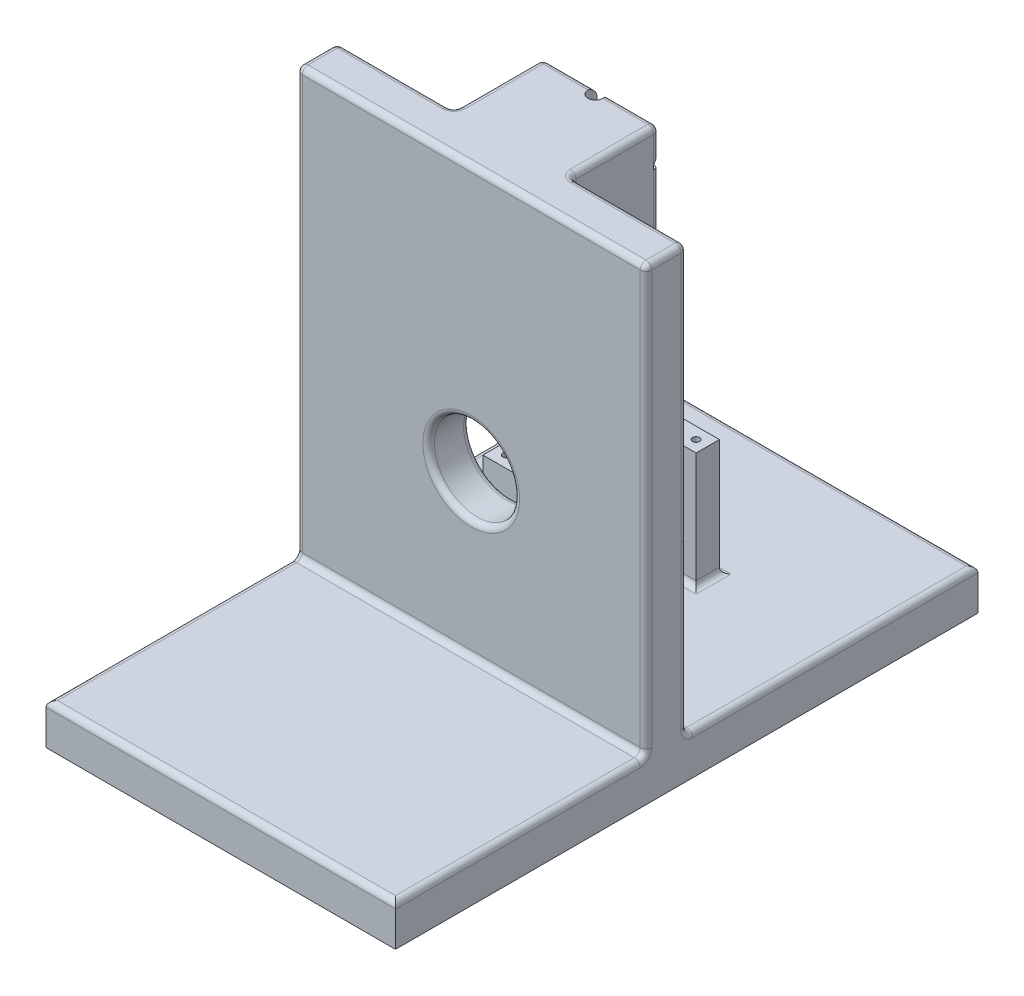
SolidWorks part; units mm, degrees
ref_plane "Płaszczyzna przednia" through (0, 0, 0) normal (0, 0, 1) x (1, 0, 0)
ref_plane "Płaszczyzna górna" through (0, 0, 0) normal (0, 1, 0) x (1, 0, 0)
ref_plane "Płaszczyzna prawa" through (0, 0, 0) normal (1, 0, 0) x (0, 0, -1)
sketch "Szkic2" plane through (0, 0, 0) normal (0, 1, 0) x (1, 0, 0)
  line L1 (300, 35) -> (-300, 35)
  line L2 (300, 35) -> (300, -35)
  line L3 (300, -35) -> (-300, -35)
  line L4 (-300, 35) -> (-300, -35)
  line L5 (300, 35) -> (-300, -35) construction
  line L6 (300, -35) -> (-300, 35) construction
  point P0 (0, 0)
  dimension "D1" = 600
  dimension "D2" = 70
extrude "Dodanie-wyciągnięcie1" add sketch "Szkic2" along normal mid plane 800 contours L3 L4 L1 L2
sketch "Szkic3" plane through (0, 0, -35) normal (0, 0, -1) x (-1, 0, 0)
  line L0 (-300, 400) -> (-300, -400) construction
  line L1 (300, -400) -> (-300, -400)
  line L2 (300, -400) -> (300, -330)
  line L3 (300, -330) -> (-300, -330)
  line L4 (-300, -400) -> (-300, -330)
  line L5 (300, -400) -> (-300, -330) construction
  line L6 (300, -330) -> (-300, -400) construction
  line L7 (0, 0) -> (0, -446.9972) construction
  point P0 (0, -365)
  dimension "D1" = 365
  dimension "D2" = 70
extrude "Dodanie-wyciągnięcie2" add sketch "Szkic3" along normal mid plane 1000
fillet "Zaokrąglenie1" radius 10 1 edges at (0, -330, -35)
fillet "Zaokrąglenie2" radius 10 1 edges at (0, -330, 35)
sketch "Szkic4" plane through (0, -330, 0) normal (0, 1, 0) x (1, 0, 0)
  line L0 (0, 0) -> (0, 207.6492) construction
  line L1 (-90, 95) -> (90, 95) construction
  line L2 (90, 75) -> (-90, 75)
  line L3 (90, 75) -> (90, 115)
  line L4 (90, 115) -> (-90, 115)
  line L5 (-90, 75) -> (-90, 115)
  line L6 (90, 75) -> (-90, 115) construction
  line L7 (90, 115) -> (-90, 75) construction
  circle A0 centre (70, 95) radius 6
  circle A1 centre (-70, 95) radius 6
  point P2 (0, 95)
  dimension "D3" = 12
  dimension "D1" = 40
  dimension "D2" = 180
  dimension "D4" = 140
  dimension "D5" = 95
extrude "Dodanie-wyciągnięcie3" add sketch "Szkic4" along normal blind 200 contours L4 L5 L2 L3
sketch "Szkic5" plane through (0, -130, 0) normal (0, 1, 0) x (1, 0, 0)
  line L0 (-90, 95) -> (90, 95) construction
  line L1 (-90, 75) -> (-90, 115) construction
  line L2 (90, 75) -> (90, 115) construction
  line L3 (0, 0) -> (0, 160.4414) construction
  circle A0 centre (70, 95) radius 6
  circle A1 centre (-70, 95) radius 6
  point P10 (0, 95)
  dimension "D1" = 12
  dimension "D3" = 70
  dimension "D2" = 70
extrude "Wytnij-wyciągnięcie1" cut sketch "Szkic5" against normal blind 80
fillet "Zaokrąglenie3" radius 10 1 edges at (0, -330, -115)
fillet "Zaokrąglenie4" radius 10 3 edges at (-90, -330, -100) (0, -330, -75) (90, -330, -100)
fillet "Zaokrąglenie5" radius 10 7 edges at (300, 40, -35) (300, -327.0711, -37.9289) (-300, 40, -35) (-300, -327.0711, -37.9289) (0, -330, -535) (300, -330, -290) (-300, -330, -290)
fillet "Zaokrąglenie6" radius 10 7 edges at (-300, 40, 35) (-300, -327.0711, 37.9289) (300, 40, 35) (300, -327.0711, 37.9289) (0, -330, 465) (-300, -330, 255) (300, -330, 255)
fillet "Zaokrąglenie7" radius 10 8 edges at (-297.0711, 400, -32.0711) (0, 400, -35) (297.0711, 400, -32.0711) (300, 400, 0) (297.0711, 400, 32.0711) (0, 400, 35) (-297.0711, 400, 32.0711) (-300, 400, 0)
sketch "Szkic7" plane through (0, 0, 35) normal (0, 0, 1) x (1, 0, 0)
  line L0 (0, 154.3024) -> (0, -357.6679) construction
  line L1 (-290, -330) -> (290, -330) construction
  circle A0 centre (0, -54) radius 73
  dimension "D2" = 146
  dimension "D1" = 276
extrude "Wytnij-wyciągnięcie2" cut sketch "Szkic7" against normal up to next
fillet "Zaokrąglenie8" radius 10 1 edges at (73, -54, 35)
fillet "Zaokrąglenie9" radius 10 1 edges at (73, -54, -35)
pattern_linear "Szyk liniowy1" count 2 spacing 186 along (0, 0, -1) of "Wytnij-wyciągnięcie1", "Dodanie-wyciągnięcie3", "Zaokrąglenie3", "Zaokrąglenie4"
sketch "Szkic10" plane through (0, 400, 0) normal (0, 1, 0) x (1, 0, 0)
  line L0 (100, 25) -> (-100, 25)
  line L1 (290, 25) -> (-290, 25) construction
  line L2 (-100, 25) -> (-100, 188.0069)
  line L3 (-100, 188.0069) -> (-50.1, 188.0069)
  line L4 (50.1, 188.0069) -> (100, 188.0069)
  line L5 (100, 188.0069) -> (100, 25)
  line L6 (0, -17.0369) -> (0, 238.1128) construction
  line L7 (-290, 25) -> (-290, -25) construction
  line L8 (0, -65) -> (0, 145) construction
  arc A0 (-50.1, 188.0069) -> (50.1, 188.0069) centre (0, 188.0069) ccw
  dimension "D4" = 163.0069
  dimension "D1" = 100
  dimension "D2" = 100
  dimension "D3" = 49.9
  dimension "D5" = 190
extrude "Dodanie-wyciągnięcie4" add sketch "Szkic10" against normal blind 260
sketch "Szkic11" plane through (0, 400, 0) normal (0, 1, 0) x (1, 0, 0)
  line L0 (-50.1, 188.0069) -> (50.1, 188.0069)
  line L1 (50.1, 188.0069) -> (50.1, 119.1854)
  line L2 (50.1, 119.1854) -> (-50.1, 119.1854)
  line L3 (-50.1, 119.1854) -> (-50.1, 188.0069)
  dimension "D1" = 121.5584
extrude "Dodanie-wyciągnięcie5" add sketch "Szkic11" against normal blind 45
fillet "Zaokrąglenie10" radius 10 14 edges at (0, 140, -35) (100, 397.0711, -32.0711) (-100, 397.0711, -32.0711) (100, 265, -35) (75.05, 140, -188.0069) (-75.05, 140, -188.0069) (-100, 140, -111.5035) (-100, 265, -35) (-100, 270, -188.0069) (-100, 400, -106.5035) (0, 400, -188.0069) (100, 400, -106.5035) (100, 270, -188.0069) (100, 140, -111.5035)
sketch "Szkic13" plane through (0, 400, 0) normal (0, 1, 0) x (1, 0, 0)
  line L0 (90, 178.0069) -> (-90, 178.0069) construction
  circle A0 centre (0, 178.0069) radius 12.5
  dimension "D1" = 25
extrude "Wytnij-wyciągnięcie9" cut sketch "Szkic13" against normal blind 45
sketch "Szkic14" plane through (100, 0, 0) normal (1, 0, 0) x (0, 0, -1)
  line L2 (178.0069, 150) -> (178.0069, 390) construction
  circle A0 centre (185.5069, 342.3424) radius 7.5
  point P2 (182.5, 378.3079)
  point P3 (182.5, 356.0274)
  point P4 (0, 0)
  point P7 (182.5, 349.3264)
  point P8 (182.5, 342.3424)
  dimension "D1" = 15
extrude "Wytnij-wyciągnięcie11" cut sketch "Szkic14" against normal blind 65 contours A0
mirror "Lustro1" about plane through (0, 0, 0) normal (1, 0, 0) of "Wytnij-wyciągnięcie11"
